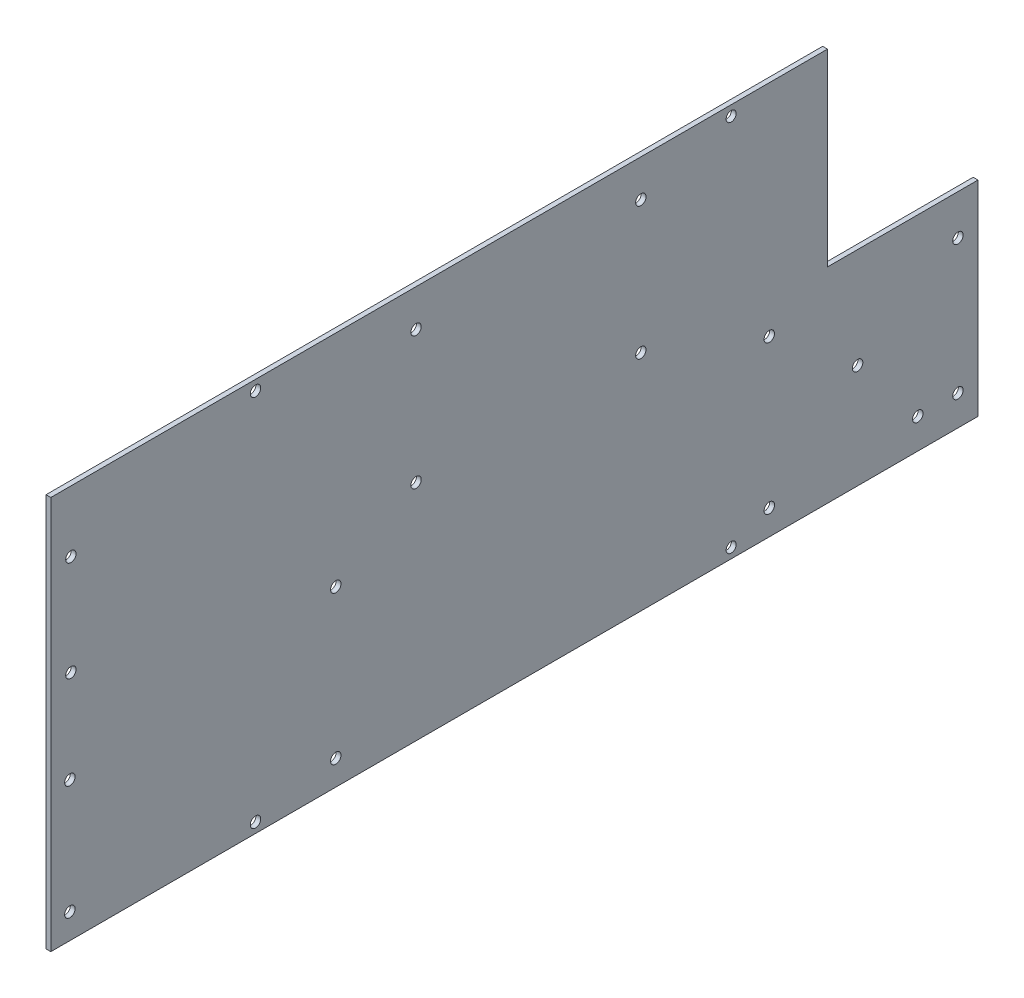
SolidWorks part; units mm, degrees
ref_plane "Front Plane" through (0, 0, 0) normal (0, 0, 1) x (1, 0, 0)
ref_plane "Top Plane" through (0, 0, 0) normal (0, 1, 0) x (1, 0, 0)
ref_plane "Right Plane" through (0, 0, 0) normal (1, 0, 0) x (0, 0, -1)
sketch "Sketch1" plane through (0, 0, 0) normal (1, 0, 0) x (0, 0, -1)
  line L0 (127, 117.7925) -> (-63.5, 117.7925) construction
  line L1 (180.975, 124.46) -> (180.975, 64.77)
  line L2 (228.6, 0) -> (-64.77, 0)
  line L3 (228.6, 0) -> (228.6, 64.77)
  line L4 (180.975, 124.46) -> (-64.77, 124.46)
  line L5 (-63.5, 117.7925) -> (-63.5, 66.9925) construction
  line L6 (127, 60.6425) -> (-43.18, 60.6425) construction
  line L7 (-58.42, 105.0925) -> (-58.42, 73.3425) construction
  line L8 (127, 60.6425) -> (127, 117.7925) construction
  line L9 (-63.5, 66.9925) -> (-43.18, 66.9925) construction
  line L10 (-43.18, 66.9925) -> (-43.18, 60.6425) construction
  line L11 (-64.77, 0) -> (-64.77, 124.46)
  line L12 (180.975, 64.77) -> (228.6, 64.77)
  circle A0 centre (121.92, 112.7125) radius 1.6383
  circle A1 centre (121.92, 70.8025) radius 1.6383
  circle A2 centre (-58.42, 73.3425) radius 1.6383
  circle A3 centre (-58.42, 105.0925) radius 1.6383
  circle A4 centre (50.8, 112.7125) radius 1.6383
  circle A5 centre (50.8, 70.8025) radius 1.6383
  circle A6 centre (162.56, 54.9275) radius 1.651
  circle A7 centre (25.4, 54.9275) radius 1.651
  circle A8 centre (25.4, 7.9375) radius 1.651
  circle A9 centre (162.56, 7.9375) radius 1.651
  circle A10 centre (-58.7375, 7.9375) radius 1.651
  circle A11 centre (-58.7375, 44.1147) radius 1.651
  circle A12 centre (0, 121.285) radius 1.651
  circle A13 centre (0, 3.175) radius 1.651
  circle A14 centre (190.5, 33.02) radius 1.651
  circle A15 centre (222.25, 52.07) radius 1.651
  circle A16 centre (150.495, 121.285) radius 1.5875
  circle A17 centre (150.495, 3.175) radius 1.5875
  dimension "D1" = 3.2766
  dimension "D15" = 3.302
  dimension "D22" = 3.302
  dimension "D25" = 3.302
  dimension "D29" = 3.302
  dimension "D36" = 3.175
  dimension "D2" = 5.08
  dimension "D3" = 20.32
  dimension "D4" = 6.35
  dimension "D5" = 12.7
  dimension "D6" = 10.16
  dimension "D7" = 185.42
  dimension "D8" = 52.07
  dimension "D9" = 44.45
  dimension "D10" = 190.5
  dimension "D11" = 57.15
  dimension "D12" = 114.3
  dimension "D13" = 137.16
  dimension "D14" = 46.99
  dimension "D16" = 25.4
  dimension "D17" = 124.46
  dimension "D18" = 7.9375
  dimension "D19" = 63.5
  dimension "D20" = 15.875
  dimension "D21" = 36.1772
  dimension "D23" = 84.1375
  dimension "D24" = 6.35
  dimension "D26" = 3.175
  dimension "D27" = 3.175
  dimension "D28" = 228.6
  dimension "D30" = 31.75
  dimension "D31" = 19.05
  dimension "D32" = 6.35
  dimension "D33" = 12.7
  dimension "D34" = 59.69
  dimension "D35" = 47.625
  dimension "D37" = 150.495
extrude "Extrude1" add sketch "Sketch1" along normal blind 1.524
sketch "Sketch2" plane through (1.524, 0, 0) normal (1, 0, 0) x (0, 0, -1)
  line L0 (-64.77, 0) -> (228.6, 0) construction
  line L1 (228.6, 0) -> (228.6, 64.77) construction
  circle A0 centre (222.25, 9.5555) radius 1.651
  circle A1 centre (209.55, 9.5555) radius 1.651
  dimension "D1" = 3.302
  dimension "D2" = 12.7
  dimension "D3" = 9.5555
  dimension "D4" = 6.35
extrude "Cut-Extrude1" cut sketch "Sketch2" against normal through all
